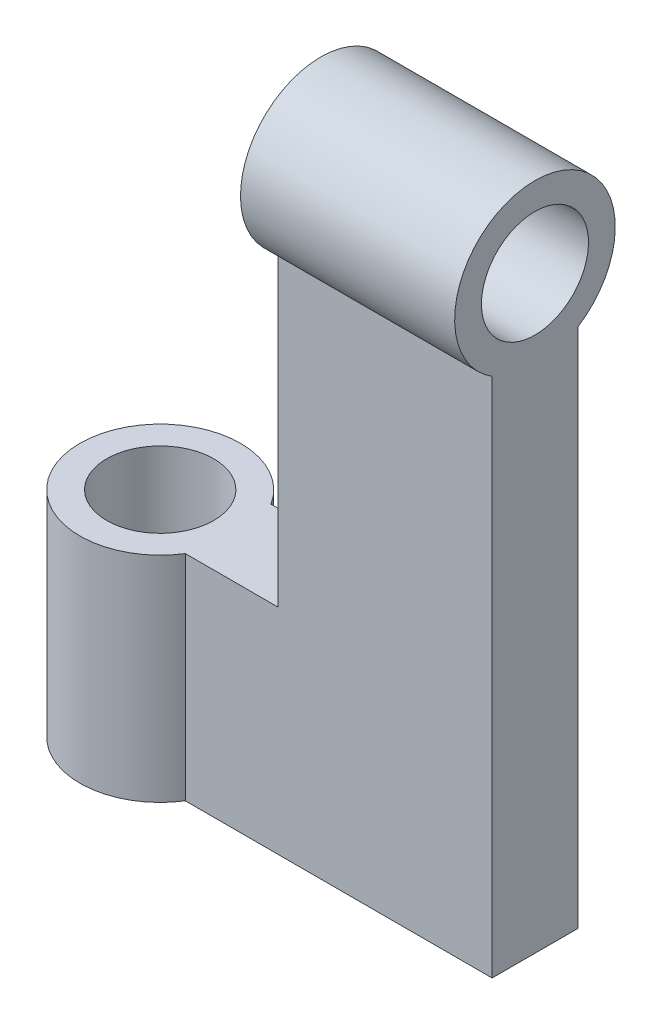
SolidWorks part; units mm, degrees
ref_plane "Plan de face" through (0, 0, 0) normal (0, 0, 1) x (1, 0, 0)
ref_plane "Plan de dessus" through (0, 0, 0) normal (0, 1, 0) x (1, 0, 0)
ref_plane "Plan de droite" through (0, 0, 0) normal (1, 0, 0) x (0, 0, -1)
sketch "Esquisse1" plane through (0, 0, 0) normal (0, 0, 1) x (1, 0, 0)
  line L0 (-48.1116, 32.8853) -> (-68.1116, 32.8853)
  line L1 (-68.1116, 32.8853) -> (-68.1116, 2.8853)
  line L2 (-78.1116, 2.8853) -> (-78.1116, -17.1147)
  line L3 (-78.1116, -17.1147) -> (-48.1116, -17.1147)
  line L4 (-48.1116, -17.1147) -> (-48.1116, 32.8853)
  line L5 (-78.1116, 2.8853) -> (-68.1116, 2.8853)
  dimension "D1" = 20
  dimension "D2" = 20
  dimension "D3" = 10
  dimension "D4" = 50
extrude "Boss.-Extru.1" add sketch "Esquisse1" along normal blind 8
sketch "Esquisse3" plane through (-48.1116, 0, 0) normal (1, 0, 0) x (0, 0, -1)
  line L0 (-8, 32.8853) -> (0, 32.8853) construction
  line L5 (0, -17.1147) -> (0, 32.8853) construction
  circle A0 centre (-4, 37.8853) radius 7.5
  circle A1 centre (-4, 37.8853) radius 5
  dimension "D2" = 10
  dimension "D3" = 15
  dimension "D1" = 5
  dimension "D4" = 4
extrude "Boss.-Extru.2" add sketch "Esquisse3" against normal up to surface (20 mm away)
sketch "Esquisse4" plane through (0, -17.1147, 0) normal (0, -1, 0) x (1, 0, 0)
  line L0 (-78.1116, 0) -> (-48.1116, 0) construction
  line L1 (-78.1116, 8) -> (-78.1116, 0) construction
  circle A0 centre (-83.1116, 4) radius 7.5
  circle A1 centre (-83.1116, 4) radius 5
  dimension "D1" = 10
  dimension "D2" = 15
  dimension "D3" = 4
  dimension "D4" = 5
extrude "Boss.-Extru.3" add sketch "Esquisse4" against normal up to surface (20 mm away)
